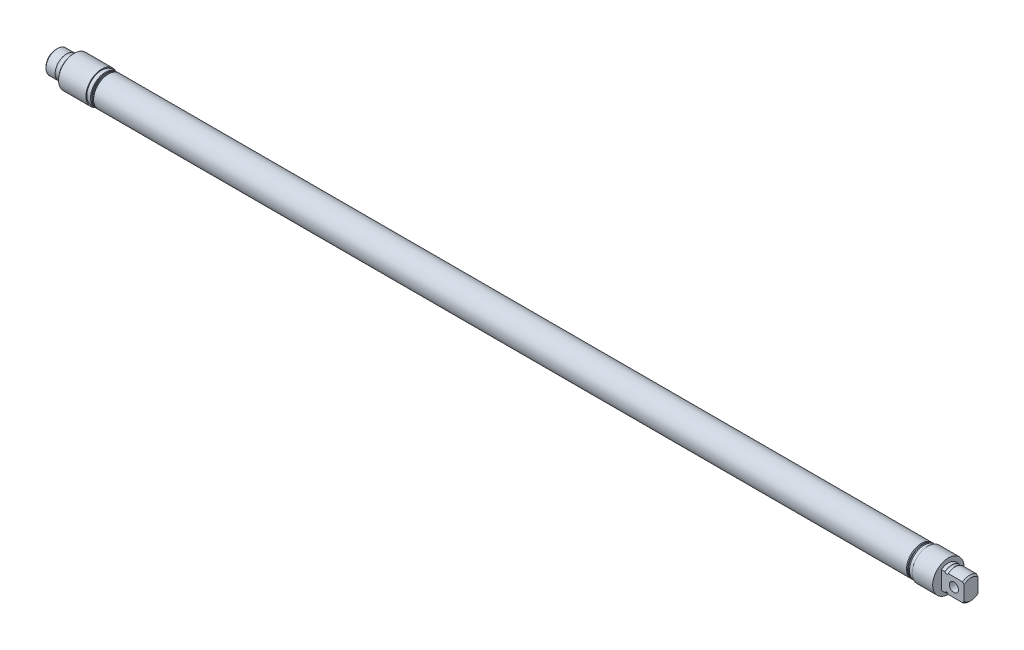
SolidWorks part; units mm, degrees
ref_plane "Front" through (0, 0, 0) normal (0, 0, 1) x (1, 0, 0)
ref_plane "Top" through (0, 0, 0) normal (0, 1, 0) x (1, 0, 0)
ref_plane "Right" through (0, 0, 0) normal (1, 0, 0) x (0, 0, -1)
sketch "Sketch2" plane through (0, 0, 0) normal (0, 0, 1) x (1, 0, 0)
  line L0 (605.79, 10.287) -> (31.75, 10.287)
  line L1 (0, 7.9375) -> (12.7, 7.9375)
  line L2 (0, 7.9375) -> (0, 0)
  line L3 (12.7, 10.922) -> (12.7, 7.9375)
  line L4 (605.79, 10.922) -> (605.79, 10.287)
  line L5 (620.014, 50) -> (620.014, -50) construction
  line L6 (0, 0) -> (620.014, 0)
  line L7 (620.014, 0) -> (620.014, 10.922)
  line L8 (-21.4174, 0) -> (42.4438, 0) construction
  line L9 (605.79, 10.922) -> (620.014, 10.922)
  line L10 (12.7, 10.922) -> (31.75, 10.922)
  line L11 (31.75, 10.922) -> (31.75, 10.287)
  line L17 (50, 0) -> (-50, 0) construction
  line L18 (620.014, 10.287) -> (620.014, -10.287) construction
  line L19 (12.7, 50) -> (12.7, -50) construction
  dimension "D1" = 15.875
  dimension "D2" = 12.7
  dimension "D3" = 14.224
  dimension "D4" = 21.844
  dimension "D5" = 19.05
revolve "Base-Revolve" add sketch "Sketch2" angle 360 about L8
sketch "Sketch3" plane through (0, 0, 0) normal (0, 0, 1) x (1, 0, 0)
  line L0 (34.29, 10.287) -> (34.29, 9.398)
  line L1 (34.29, 9.398) -> (35.179, 10.287)
  line L2 (35.179, 10.287) -> (34.29, 10.287)
  line L4 (35.56, 10.287) -> (35.56, 9.398)
  line L5 (35.56, 9.398) -> (36.449, 10.287)
  line L6 (36.449, 10.287) -> (35.56, 10.287)
  line L9 (31.75, -10.922) -> (31.75, 10.922) construction
  line L15 (0, 0) -> (35.6608, 0) construction
  line L16 (50, 0) -> (-50, 0) construction
  circle A0 centre (34.925, 9.398) radius 0.635 construction
  dimension "D4" = 20.574
  dimension "D1" = 1.27
  dimension "D2" = 0.889
  dimension "D3" = 2.54
revolve "Cut-Revolve1" cut sketch "Sketch3" angle 360 about L15
sketch "Sketch6" plane through (0, 0, 0) normal (0, 0, 1) x (1, 0, 0)
  line L0 (0, 0) -> (-63.9853, 0) construction
  line L1 (12.7, 0) -> (620.014, 0) construction
  line L2 (589.407, 0) -> (589.407, 9.525)
  line L3 (589.407, 9.525) -> (43.307, 9.525)
  line L4 (43.307, 9.525) -> (43.307, 3.175)
  line L5 (43.307, 3.175) -> (0, 3.175)
  line L6 (0, 3.175) -> (0, 0)
  line L7 (0, 0) -> (589.407, 0)
  line L8 (589.407, 10.287) -> (589.407, -10.287) construction
  line L10 (43.307, 10.287) -> (43.307, -10.287) construction
  line L11 (50, 0) -> (-50, 0) construction
  line L12 (0, 7.9375) -> (0, -7.9375) construction
  dimension "D1" = 6.35
  dimension "D2" = 19.05
revolve "Cut-Revolve2" cut sketch "Sketch6" angle 360 about L0
sketch "Sketch8" plane through (620.014, 0, 0) normal (1, 0, 0) x (0, 0, -1)
  circle A0 centre (0, 0) radius 7.9375
  dimension "D1" = 15.875
extrude "Boss-Extrude1" add sketch "Sketch8" along normal offset from surface (15.748 mm away) 7.112
sketch "Sketch11" plane through (0, 0, 0) normal (0, 0, 1) x (1, 0, 0)
  line L0 (0, 0) -> (161.0301, 0) construction
  line L1 (620.014, -7.9375) -> (635.762, -7.9375) construction
  line L2 (620.014, -10.287) -> (620.014, 10.287) construction
  line L3 (622.427, -7.9375) -> (624.713, -7.9375)
  arc A0 (624.713, -7.9375) -> (622.427, -7.9375) centre (623.57, -8.4911) ccw
  dimension "D2" = 1.27
  dimension "D1" = 2.286
  dimension "D3" = 2.286
revolve "Cut-Revolve3" cut sketch "Sketch11" angle 360 about L0
sketch "Sketch9" plane through (635.762, 0, 0) normal (1, 0, 0) x (0, 0, -1)
  line L0 (-4.826, 6.3019) -> (-4.826, -6.3019)
  line L1 (4.826, 6.3019) -> (4.826, -6.3019)
  line L2 (0, 0) -> (0, 6.2016) construction
  circle A0 centre (0, 0) radius 7.9375 construction
  arc A1 (4.826, -6.3019) -> (4.826, 6.3019) centre (0, 0) ccw
  arc A2 (-4.826, 6.3019) -> (-4.826, -6.3019) centre (0, 0) ccw
  dimension "D1" = 9.652
extrude "Cut-Extrude1" cut sketch "Sketch9" against normal up to surface (15.748 mm away)
sketch "Sketch10" plane through (0, 0, 4.826) normal (0, 0, 1) x (1, 0, 0)
  line L0 (628.65, 33.9884) -> (628.65, -33.9884) construction
  circle A0 centre (628.65, 0) radius 3.175
  dimension "D1" = 6.35
extrude "Cut-Extrude2" cut sketch "Sketch10" against normal up to surface (9.652 mm away)
sketch "Sketch12" plane through (0, 0, 0) normal (0, 0, 1) x (1, 0, 0)
  line L0 (-3.5589, 0) -> (43.8935, 0) construction
  line L1 (622.427, 0) -> (620.014, 0) construction
  line L2 (0, -7.9375) -> (12.7, -7.9375) construction
  line L3 (7.366, -7.9375) -> (10.414, -7.9375)
  line L4 (12.7, 10.922) -> (12.7, -10.922) construction
  arc A0 (10.414, -7.9375) -> (7.366, -7.9375) centre (8.89, -9.2815) ccw
  dimension "D1" = 2.032
  dimension "D2" = 3.048
  dimension "D3" = 2.286
revolve "Cut-Revolve4" cut sketch "Sketch12" angle 360 about L0
sketch "Sketch13" plane through (0, 0, 0) normal (0, 0, 1) x (1, 0, 0)
  line L0 (601.218, 10.287) -> (601.98, 10.287)
  line L1 (601.98, 10.287) -> (601.98, 9.525)
  line L2 (601.98, 9.525) -> (601.218, 10.287)
  line L3 (602.488, 10.287) -> (603.25, 10.287)
  line L4 (603.25, 10.287) -> (603.25, 9.525)
  line L5 (603.25, 9.525) -> (602.488, 10.287)
  line L6 (605.79, 10.922) -> (605.79, -10.922) construction
  line L7 (-1.0396, 0) -> (114.518, 0) construction
  line L8 (622.427, 0) -> (620.014, 0) construction
  dimension "D1" = 1.27
  dimension "D2" = 0.762
  dimension "D3" = 2.54
  dimension "D4" = 20.574
revolve "Cut-Revolve5" cut sketch "Sketch13" angle 360 about L7
chamfer "Chamfer1" distance 1.016 angle 45 2 edges at (635.762, 7.9375, 0) (635.762, -7.9375, 0)
chamfer "Chamfer2" distance 1.016 angle 45 1 edges at (0, 0, 7.9375)
ref_plane "Plane1" through (22.225, 10.922, 0) normal (0, 1, 0) x (0, 0, -1)
